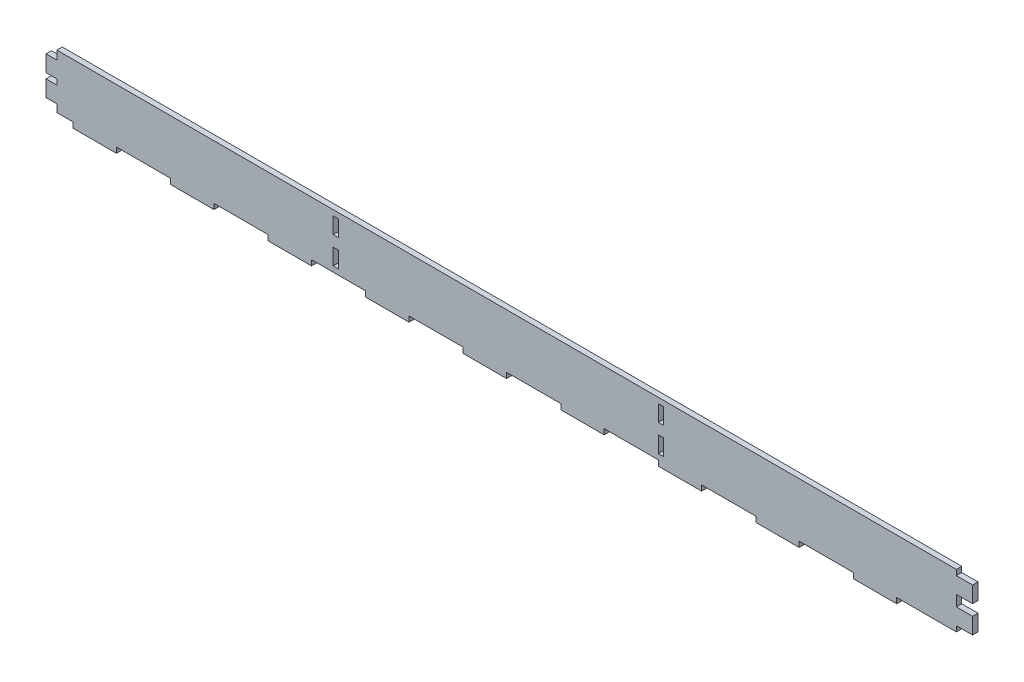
SolidWorks part; units mm, degrees
ref_plane "Front Plane" through (0, 0, 0) normal (0, 0, 1) x (1, 0, 0)
ref_plane "Top Plane" through (0, 0, 0) normal (0, 1, 0) x (1, 0, 0)
ref_plane "Right Plane" through (0, 0, 0) normal (1, 0, 0) x (0, 0, -1)
sketch "Model" plane through (0, 0, 0) normal (0, 0, 1) x (1, 0, 0)
  line L0 (-590, 20) -> (-590, 5)
  line L1 (-590, 5) -> (-585, 5)
  line L2 (-585, 5) -> (-585, 20)
  line L3 (-585, 20) -> (-590, 20)
  line L4 (610, 20) -> (610, 5)
  line L5 (610, 5) -> (615, 5)
  line L6 (615, 5) -> (615, 20)
  line L7 (615, 20) -> (610, 20)
  line L8 (-590, 45) -> (-590, 30)
  line L9 (-590, 30) -> (-585, 30)
  line L10 (-585, 30) -> (-585, 45)
  line L11 (-585, 45) -> (-590, 45)
  line L12 (610, 45) -> (610, 30)
  line L13 (610, 30) -> (615, 30)
  line L14 (615, 30) -> (615, 45)
  line L15 (615, 45) -> (610, 45)
  line L16 (310, 20) -> (310, 5)
  line L17 (310, 5) -> (315, 5)
  line L18 (315, 5) -> (315, 20)
  line L19 (315, 20) -> (310, 20)
  line L20 (310, 45) -> (310, 30)
  line L21 (310, 30) -> (315, 30)
  line L22 (315, 30) -> (315, 45)
  line L23 (315, 45) -> (310, 45)
  line L24 (10, 20) -> (10, 5)
  line L25 (10, 5) -> (15, 5)
  line L26 (15, 5) -> (15, 20)
  line L27 (15, 20) -> (10, 20)
  line L28 (10, 45) -> (10, 30)
  line L29 (10, 30) -> (15, 30)
  line L30 (15, 30) -> (15, 45)
  line L31 (15, 45) -> (10, 45)
  line L32 (-290, 20) -> (-290, 5)
  line L33 (-290, 5) -> (-285, 5)
  line L34 (-285, 5) -> (-285, 20)
  line L35 (-290, 45) -> (-290, 30)
  line L36 (-290, 30) -> (-285, 30)
  line L37 (-285, 30) -> (-285, 45)
  line L38 (-285, 45) -> (-290, 45)
  line L39 (-285, 20) -> (-290, 20)
  line L40 (-885, 0) -> (-830, 0)
  line L41 (-830, 0) -> (-830, -5)
  line L42 (-830, -5) -> (-790, -5)
  line L43 (-790, -5) -> (-790, 0)
  line L44 (-790, 0) -> (-740, 0)
  line L45 (-740, 0) -> (-740, -5)
  line L46 (-740, -5) -> (-700, -5)
  line L47 (-700, -5) -> (-700, 0)
  line L48 (-700, 0) -> (-650, 0)
  line L49 (-650, 0) -> (-650, -5)
  line L50 (-650, -5) -> (-610, -5)
  line L51 (-610, -5) -> (-610, 0)
  line L52 (-610, 0) -> (-560, 0)
  line L53 (-560, 0) -> (-560, -5)
  line L54 (-560, -5) -> (-520, -5)
  line L55 (-520, -5) -> (-520, 0)
  line L56 (-520, 0) -> (-470, 0)
  line L57 (-470, 0) -> (-470, -5)
  line L58 (-470, -5) -> (-430, -5)
  line L59 (-430, -5) -> (-430, 0)
  line L60 (-430, 0) -> (-380, 0)
  line L61 (-380, 0) -> (-380, -5)
  line L62 (-380, -5) -> (-340, -5)
  line L63 (-340, -5) -> (-340, 0)
  line L64 (-340, 0) -> (-290, 0)
  line L65 (-290, 0) -> (-290, -5)
  line L66 (-290, -5) -> (-250, -5)
  line L67 (-250, -5) -> (-250, 0)
  line L68 (-250, 0) -> (-200, 0)
  line L69 (-200, 0) -> (-200, -5)
  line L70 (-200, -5) -> (-160, -5)
  line L71 (-160, -5) -> (-160, 0)
  line L72 (-160, 0) -> (-110, 0)
  line L73 (-110, 0) -> (-110, -5)
  line L74 (-110, -5) -> (-70, -5)
  line L75 (-70, -5) -> (-70, 0)
  line L76 (-70, 0) -> (-20, 0)
  line L77 (-20, 0) -> (-20, -5)
  line L78 (-20, -5) -> (20, -5)
  line L79 (20, -5) -> (20, 0)
  line L80 (20, 0) -> (70, 0)
  line L81 (70, 0) -> (70, -5)
  line L82 (70, -5) -> (110, -5)
  line L83 (110, -5) -> (110, 0)
  line L84 (110, 0) -> (160, 0)
  line L85 (160, 0) -> (160, -5)
  line L86 (160, -5) -> (200, -5)
  line L87 (200, -5) -> (200, 0)
  line L88 (200, 0) -> (250, 0)
  line L89 (250, 0) -> (250, -5)
  line L90 (250, -5) -> (290, -5)
  line L91 (290, -5) -> (290, 0)
  line L92 (290, 0) -> (340, 0)
  line L93 (340, 0) -> (340, -5)
  line L94 (340, -5) -> (380, -5)
  line L95 (380, -5) -> (380, 0)
  line L96 (380, 0) -> (430, 0)
  line L97 (430, 0) -> (430, -5)
  line L98 (430, -5) -> (470, -5)
  line L99 (470, -5) -> (470, 0)
  line L100 (470, 0) -> (520, 0)
  line L101 (520, 0) -> (520, -5)
  line L102 (520, -5) -> (560, -5)
  line L103 (560, -5) -> (560, 0)
  line L104 (560, 0) -> (610, 0)
  line L105 (610, 0) -> (610, -5)
  line L106 (610, -5) -> (650, -5)
  line L107 (650, -5) -> (650, 0)
  line L108 (650, 0) -> (700, 0)
  line L109 (700, 0) -> (700, -5)
  line L110 (700, -5) -> (740, -5)
  line L111 (740, -5) -> (740, 0)
  line L112 (740, 0) -> (790, 0)
  line L113 (790, 0) -> (790, -5)
  line L114 (790, -5) -> (830, -5)
  line L115 (830, -5) -> (830, 0)
  line L116 (830, 0) -> (885, 0)
  line L117 (885, 0) -> (885, 5)
  line L118 (885, 5) -> (900, 5)
  line L119 (900, 5) -> (900, 20)
  line L120 (900, 20) -> (885, 20)
  line L121 (885, 20) -> (885, 30)
  line L122 (885, 30) -> (900, 30)
  line L123 (900, 30) -> (900, 45)
  line L124 (900, 45) -> (885, 45)
  line L125 (885, 45) -> (885, 50)
  line L126 (885, 50) -> (-885, 50)
  line L127 (-885, 50) -> (-885, 45)
  line L128 (-885, 45) -> (-900, 45)
  line L129 (-900, 45) -> (-900, 30)
  line L130 (-900, 30) -> (-885, 30)
  line L131 (-885, 30) -> (-885, 20)
  line L132 (-885, 20) -> (-900, 20)
  line L133 (-900, 20) -> (-900, 5)
  line L134 (-900, 5) -> (-885, 5)
  line L135 (-885, 5) -> (-885, 0)
extrude "Boss-Extrude1" add sketch "Model" along normal blind 5 contours L126 L127 L128 L129 L130 L131 L132 L133 L134 L135 L40 L41 L42 L43 L44 L45 L46 L47 L48 L49 L50 L51 L52 L53 L54 L55 L56 L57 L58 L59 L60 L61 L62 L63 L64 L65 L66 L67 L68 L69 L70 L71 L72 L73 L74 L75 L76 L77 L78 L79 L80 L81 L82 L83 L84 L85 L86 L87 L88 L89 L90 L91 L92 L93 L94 L95 L96 L97 L98 L99 L100 L101 L102 L103 L104 L105 L106 L107 L108 L109 L110 L111 L112 L113 L114 L115 L116 L117 L118 L119 L120 L121 L122 L123 L124 L125
sketch "Sketch1" plane through (0, 0, 5) normal (0, 0, 1) x (1, 0, 0)
  line L0 (55, 50) -> (55, 42)
  line L1 (885, 50) -> (-885, 50) construction
  line L2 (55, 42) -> (45, 42)
  line L3 (45, 42) -> (45, 27)
  line L4 (45, 27) -> (55, 27)
  line L5 (55, 27) -> (55, 22)
  line L6 (55, 22) -> (45, 22)
  line L7 (45, 22) -> (45, 7)
  line L8 (45, 7) -> (55, 7)
  line L9 (55, 7) -> (55, 0)
  line L10 (20, 0) -> (70, 0) construction
  line L14 (55, 50) -> (-1184.2193, 174.4728)
  line L15 (-1184.2193, 174.4728) -> (-782.7438, -337.8579)
  line L16 (-782.7438, -337.8579) -> (55, 0)
  dimension "D1" = 5
  dimension "D2" = 10
  dimension "D3" = 10
  dimension "D4" = 10
  dimension "D5" = 10
  dimension "D6" = 8
  dimension "D7" = 15
  dimension "D8" = 15
  dimension "D9" = 35
extrude "Cut-Extrude1" cut sketch "Sketch1" against normal through all
